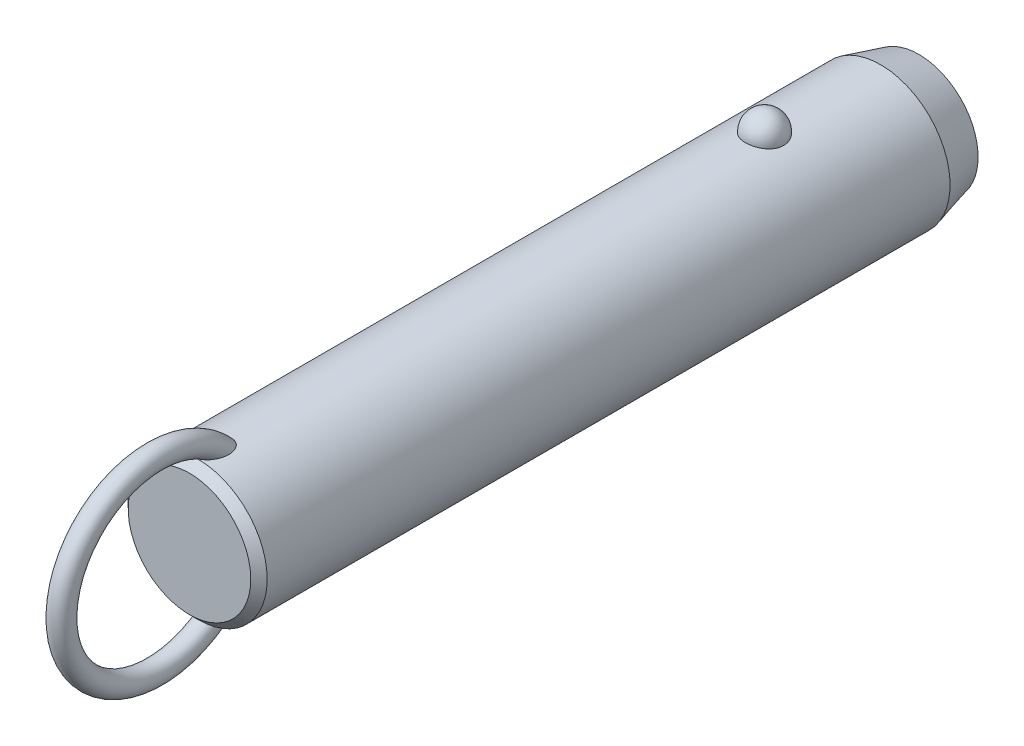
SolidWorks part; units mm, degrees
ref_plane "Front Plane" through (0, 0, 0) normal (0, 0, 1) x (1, 0, 0)
ref_plane "Top Plane" through (0, 0, 0) normal (0, 1, 0) x (1, 0, 0)
ref_plane "Right Plane" through (0, 0, 0) normal (1, 0, 0) x (0, 0, -1)
sketch "Sketch2" plane through (0, 0, 0) normal (0, 0, 1) x (1, 0, 0)
  circle A0 centre (0, 0) radius 12.7
  point P3 (0, 12.7)
  dimension "D1" = 25.4
extrude "Boss-Extrude1" add sketch "Sketch2" along normal blind 88.9
sketch "Sketch3" plane through (0, 0, 0) normal (0, 0, -1) x (-1, 0, 0)
  circle A0 centre (0, 0) radius 12.7
  dimension "D1" = 25.4
extrude "Boss-Extrude2" add sketch "Sketch3" along normal blind 31.7
chamfer "Chamfer1" distance 7 angle 15 1 edges at (-12.7, 0, -31.7)
sketch "Sketch12" plane through (0, 0, 0) normal (1, 0, 0) x (0, 0, -1)
  line L0 (-88.9, 12.7) -> (-88.9, -12.7) construction
  point P0 (-88.9, 0)
sketch "Sketch13" plane through (0, 0, 0) normal (1, 0, 0) x (0, 0, -1)
  circle A0 centre (-107.95, 0) radius 19.05
  point P2 (-88.9, 0)
  dimension "D1" = 38.1
sketch "Sketch14" plane through (0, 0, 0) normal (0, 1, 0) x (1, 0, 0)
  circle A0 centre (0, -90.9) radius 2
  point P2 (0, -88.9)
  dimension "D1" = 4
sweep "Sweep1" add profiles "Sketch14" path "Sketch13"
sketch "Sketch15" plane through (0, 0, 88.9) normal (0, 0, 1) x (1, 0, 0)
  circle A0 centre (0, 0) radius 12.7
  dimension "D1" = 25.4
extrude "Boss-Extrude3" add sketch "Sketch15" along normal blind 12.7
chamfer "Chamfer2" distance 1.5 angle 45 1 edges at (12.7, 0, 101.6)
sketch "Sketch18" plane through (0, 0, 0) normal (1, 0, 0) x (0, 0, -1)
  line L0 (24.7, 12.7) -> (-93.751, 12.7) construction
  line L1 (3.5, 16.2) -> (3.5, 9.2)
  line L2 (-93.751, -12.7) -> (24.7, -12.7) construction
  arc A0 (3.5, 16.2) -> (3.5, 9.2) centre (3.5, 12.7) ccw
  point P4 (0, 12.7)
  dimension "D1" = 28.9
revolve "Revolve1" add sketch "Sketch18" angle 360 about L1
